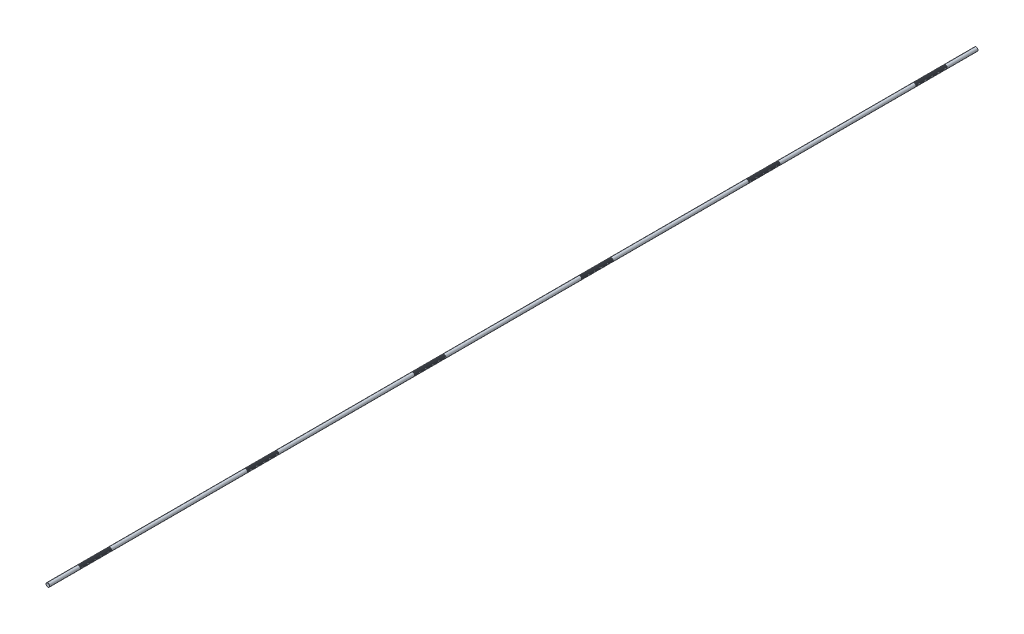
SolidWorks part; units mm, degrees
ref_plane "Front Plane" through (0, 0, 0) normal (0, 0, 1) x (1, 0, 0)
ref_plane "Top Plane" through (0, 0, 0) normal (0, 1, 0) x (1, 0, 0)
ref_plane "Right Plane" through (0, 0, 0) normal (1, 0, 0) x (0, 0, -1)
sketch "Sketch1" plane through (0, 0, 0) normal (0, 0, 1) x (1, 0, 0)
  circle A0 centre (0, 0) radius 6
  dimension "D1" = 12
extrude "Boss-Extrude1" add sketch "Sketch1" along normal mid plane 3000
chamfer "Chamfer1" distance 0.3 angle 45 2 edges at (6, 0, -1500) (6, 0, 1500)
sketch "Sketch2" plane through (0, 0, 0) normal (1, 0, 0) x (0, 0, -1)
  line L0 (1400.2345, 6) -> (1398.2655, 6)
  line L1 (1499.7, 6) -> (-1499.7, 6) construction
  line L2 (1398.2655, 6) -> (1398.7345, 4.25)
  line L3 (1398.7345, 4.25) -> (1399.7655, 4.25)
  line L4 (1399.7655, 4.25) -> (1400.2345, 6)
  line L5 (1500, -5.7) -> (1500, 5.7) construction
  point P4 (1399.25, 6)
  point P7 (1399.25, 4.25)
  point P8 (1400, 5.125)
  point P9 (1398.5, 5.125)
  dimension "D1" = 1.5
  dimension "D2" = 100
  dimension "D3" = 1.75
  dimension "D4" = 30
revolve "Cut-Revolve1" cut sketch "Sketch2" angle 360 about axis through (0, 0, 1500) along (0, 0, -1)
pattern_linear "LPattern1" count 34 spacing 3 along (0, 0, 1) of "Cut-Revolve1"
pattern_linear "LPattern2" count 6 spacing 540 along (0, 0, 1) of "Cut-Revolve1", "LPattern1"
